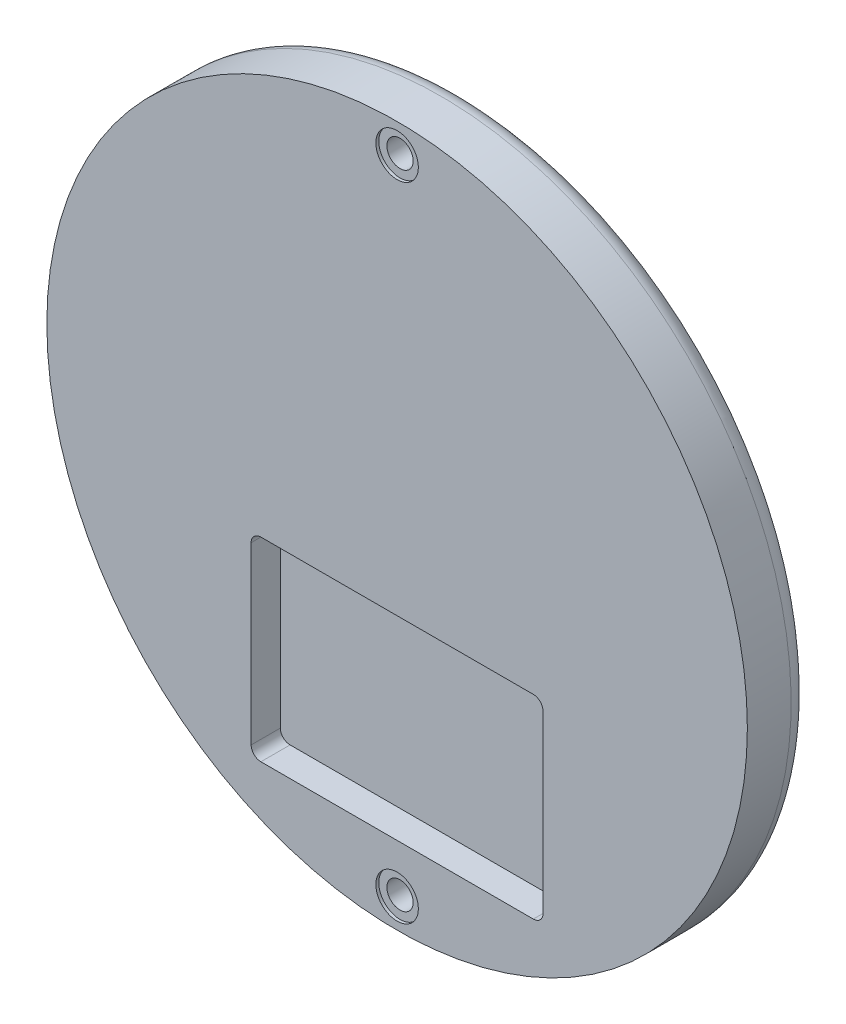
SolidWorks part; units mm, degrees
ref_plane "Front Plane" through (0, 0, 0) normal (0, 0, 1) x (1, 0, 0)
ref_plane "Top Plane" through (0, 0, 0) normal (0, 1, 0) x (1, 0, 0)
ref_plane "Right Plane" through (0, 0, 0) normal (1, 0, 0) x (0, 0, -1)
sketch "Sketch1" plane through (0, 0, 0) normal (0, 0, 1) x (1, 0, 0)
  circle A0 centre (0, 0) radius 36
  dimension "D1" = 72
extrude "Boss-Extrude1" add sketch "Sketch1" along normal blind 6.5
sketch "Sketch2" plane through (0, 0, 0) normal (0, 0, -1) x (-1, 0, 0)
  line L0 (0, 36) -> (0, -36) construction
  line L1 (-36, 0) -> (36, 0) construction
  circle A0 centre (0, 0) radius 36 construction
  circle A1 centre (0, 0) radius 33 construction
  circle A2 centre (0, 33) radius 1.9844
  circle A3 centre (0, -33) radius 1.9844
  dimension "D1" = 66
  dimension "D2" = 3.9688
hole_wizard "#4-40 Tapped Hole1" positions "Sketch9" profile "Sketch10" tap size "#4-40" standard "ANSI Inch"
sketch "Sketch9" plane through (0, 0, 0) normal (0, 0, -1) x (-1, 0, 0)
  point P0 (0, -33)
sketch "Sketch10" plane through (0, -33, 0) normal (1, 0, 0) x (0, 1, 0)
  line L0 (0, 0) -> (0, 7.3112)
  line L1 (0, 7.3112) -> (1.35, 6.5)
  line L2 (1.35, 6.5) -> (1.35, 1.1328)
  line L3 (1.35, 1.1328) -> (2.7, 0)
  line L5 (2.7, 0) -> (0, 0)
  line L6 (-1.35, 1.1328) -> (-2.7, 0) construction
  line L10 (0, 7.3112) -> (-1.35, 6.5) construction
  line L11 (0, -6.35) -> (0, 107.95) construction
  dimension "Tap Drill Dia." = 2.7
  dimension "Tap Drill Depth" = 6.5
  dimension "Near C'Sink Dia." = 5.4
  dimension "Near C'Sink Angle" = 100
  dimension "Drill Angle" = 118
sketch "Sketch11" plane through (0, 0, 6.5) normal (0, 0, 1) x (1, 0, 0)
  circle A0 centre (0, -33) radius 2.1844
  dimension "D1" = 4.3688
extrude "Cut-Extrude3" cut sketch "Sketch11" against normal blind 0.3
ref_plane "Plane2" through (0, 0, 0) normal (0, -1, 0) x (-1, 0, 0)
mirror "Mirror1" about plane through (0, 0, 0) normal (0, -1, 0) of "Cut-Extrude3", "#4-40 Tapped Hole1"
fillet "Fillet1" radius 2 1 edges at (36, 0, 0)
sketch "Sketch12" plane through (0, 0, 6.5) normal (0, 0, 1) x (1, 0, 0)
  line L0 (0, 36) -> (0, -36) construction
  line L1 (14, -8) -> (-14, -8)
  line L2 (15, -9) -> (15, -27)
  line L3 (14, -28) -> (-14, -28)
  line L4 (-15, -9) -> (-15, -27)
  line L5 (15, -8) -> (-15, -28) construction
  line L6 (15, -28) -> (-15, -8) construction
  arc A0 (14, -8) -> (15, -9) centre (14, -9) cw
  arc A1 (15, -27) -> (14, -28) centre (14, -27) cw
  arc A2 (-14, -28) -> (-15, -27) centre (-14, -27) cw
  arc A3 (-14, -8) -> (-15, -9) centre (-14, -9) ccw
  point P0 (0, -18)
  dimension "D4" = 1
  dimension "D1" = 5
  dimension "D2" = 20
  dimension "D3" = 30
extrude "Cut-Extrude4" cut sketch "Sketch12" against normal blind 3
